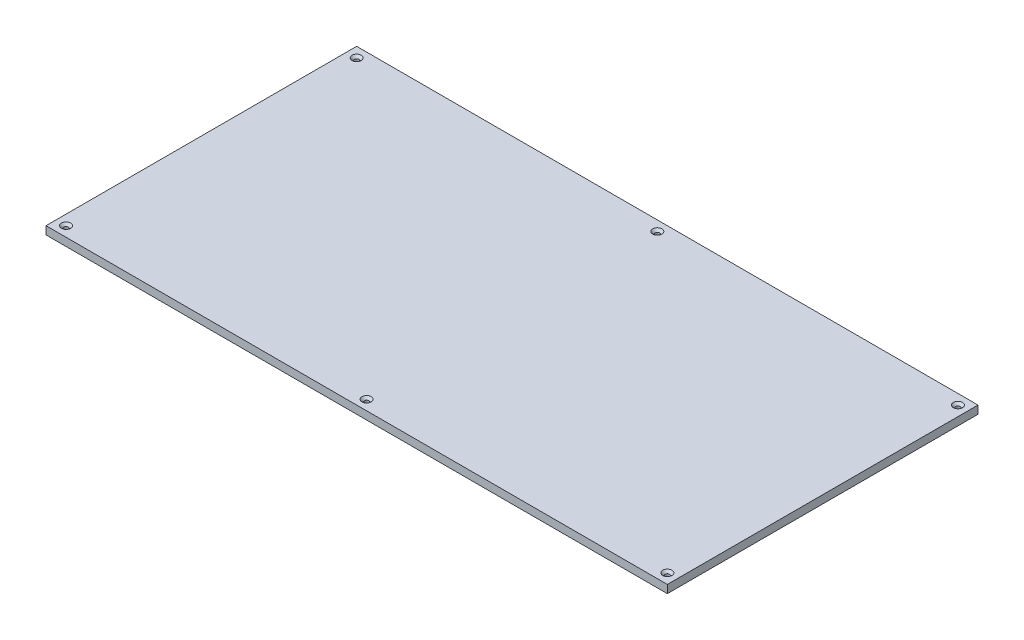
SolidWorks part; units mm, degrees
ref_plane "Ebene vorne" through (0, 0, 0) normal (0, 0, 1) x (1, 0, 0)
ref_plane "Ebene oben" through (0, 0, 0) normal (0, 1, 0) x (1, 0, 0)
ref_plane "Ebene rechts" through (0, 0, 0) normal (1, 0, 0) x (0, 0, -1)
sketch "Skizze1" plane through (0, 0, 0) normal (0, 1, 0) x (1, 0, 0)
  line L1 (-310, -155) -> (310, -155)
  line L2 (-310, -155) -> (-310, 155)
  line L3 (-310, 155) -> (310, 155)
  line L4 (310, -155) -> (310, 155)
  line L5 (-310, -155) -> (310, 155) construction
  line L6 (-310, 155) -> (310, -155) construction
  point P0 (0, 0)
  dimension "D1" = 310
  dimension "D2" = 620
extrude "Aufsatz-Linear austragen1" add sketch "Skizze1" along normal blind 8
hole_wizard "Formsenkung für M4 Senkschraube mit Innensechskant1" positions "Skizze2" profile "Skizze3" countersink size "M4" standard "DIN"
sketch "Skizze2" plane through (0, 8, 0) normal (0, 1, 0) x (1, 0, 0)
  line L0 (310, 155) -> (-310, 155) construction
  line L1 (-310, -155) -> (310, -155) construction
  line L2 (-310, 155) -> (-310, -155) construction
  line L3 (310, -155) -> (310, 155) construction
  point P0 (-300, -145)
  point P2 (0, -145)
  point P4 (300, -145)
  point P6 (300, 145)
  point P8 (0, 145)
  point P10 (-300, 145)
  dimension "D1" = 10
  dimension "D2" = 10
  dimension "D3" = 10
  dimension "D5" = 10
sketch "Skizze3" plane through (-300, 8, 145) normal (1, 0, 0) x (0, 0, 1)
  line L0 (0, 0) -> (0, 8)
  line L1 (0, 8) -> (2.25, 8)
  line L2 (2.25, 8) -> (2.25, 2.35)
  line L3 (2.25, 2.35) -> (4.6, 0)
  line L5 (4.6, 0) -> (0, 0)
  line L6 (-2.25, 2.35) -> (-4.6, 0) construction
  line L11 (0, -6.35) -> (0, 107.95) construction
  dimension "Bohrerdurchmesser" = 4.5
  dimension "Bohrungstiefe" = 8
  dimension "Senkdurchmesser (Oben)" = 9.2
  dimension "Senkwinkel (Oben)" = 90
